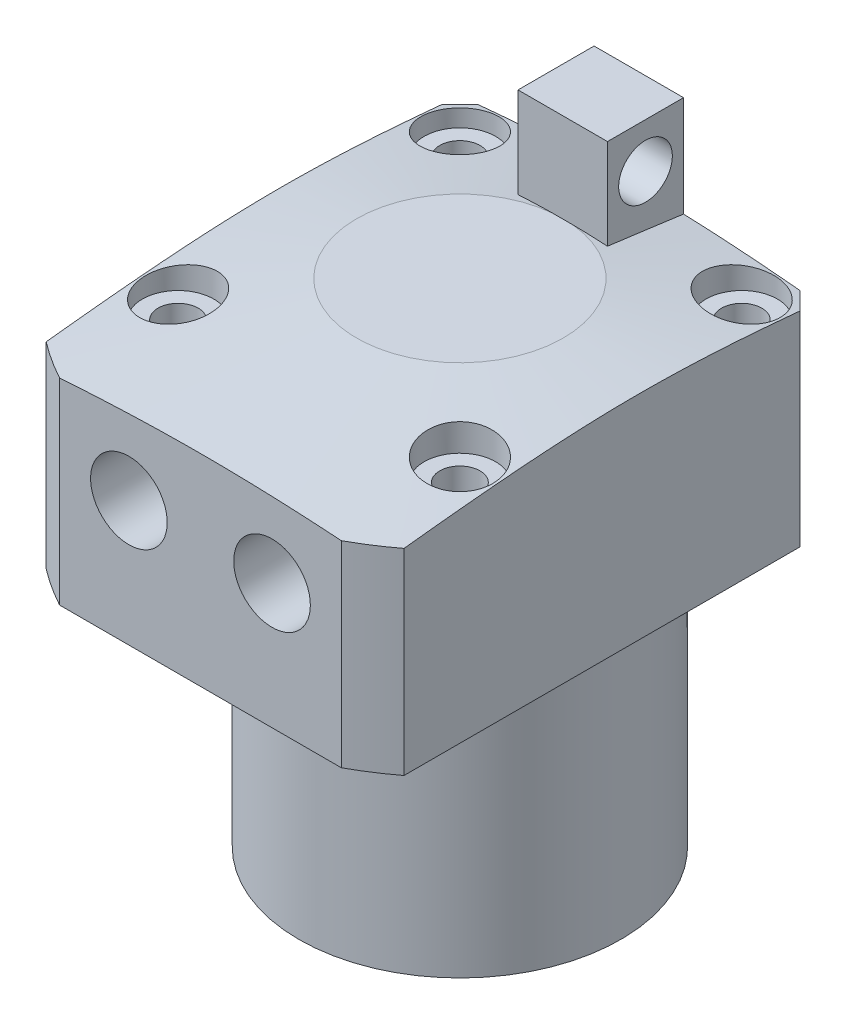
SolidWorks part; units mm, degrees
ref_plane "Front Plane" through (0, 0, 0) normal (0, 0, 1) x (1, 0, 0)
ref_plane "Top Plane" through (0, 0, 0) normal (0, 1, 0) x (1, 0, 0)
ref_plane "Right Plane" through (0, 0, 0) normal (1, 0, 0) x (0, 0, -1)
sketch "Sketch1" plane through (0, 0, 0) normal (0, 0, 1) x (1, 0, 0)
  line L0 (0, 87.0508) -> (0, 0) construction
  line L1 (0, 0) -> (-18, 0)
  line L2 (-18, 0) -> (-18, 30)
  line L3 (-18, 30) -> (-33, 30)
  line L4 (-33, 30) -> (-33, 51.9861)
  line L6 (-11.5549, 55) -> (0, 55)
  line L7 (0, 0) -> (0, 55)
  line L8 (-11.5549, 55) -> (-33, 51.9861)
  point P8 (-33, 55)
  dimension "D1" = 18
  dimension "D2" = 30
  dimension "D3" = 33
  dimension "D4" = 8
  dimension "D5" = 25
revolve "Revolve1" add sketch "Sketch1" angle 360 about L0
sketch "Sketch2" plane through (0, 55, 0) normal (0, 1, 0) x (1, 0, 0)
  line L0 (0, 0) -> (0, 20) construction
  line L1 (-20, 20) -> (20, 20)
  line L2 (-20, 20) -> (-20, -29)
  line L3 (-20, -29) -> (20, -29)
  line L4 (20, 20) -> (20, -29)
  dimension "D1" = 49
  dimension "D2" = 40
  dimension "D3" = 20
extrude "Cut-Extrude2" cut sketch "Sketch2" against normal through all flip side to cut
chamfer "Chamfer1" distance 2 angle 45 2 edges at (20, 41.3244, -20) (-20, 41.3244, -20)
hole_wizard "G1/8 Tapped Hole1" positions "Sketch6" profile "Sketch5" tap size "G1/8" standard "ISO"
sketch "Sketch6" plane through (0, 0, 29) normal (0, 0, 1) x (1, 0, 0)
  line L0 (-8, 44) -> (8, 44) construction
  line L4 (0, 44) -> (0, 55) construction
  line L5 (-15.748, 55) -> (15.748, 55) construction
  point P0 (-8, 44)
  point P1 (8, 44)
  dimension "D1" = 11
  dimension "D2" = 16
sketch "Sketch5" plane through (-8, 44, 29) normal (1, 0, 0) x (0, -1, 0)
  line L0 (0, 0) -> (0, 22.18)
  line L1 (0, 22.18) -> (4.283, 22.18)
  line L2 (4.283, 22.18) -> (4.283, 0)
  line L5 (4.283, 0) -> (0, 0)
  line L10 (0, 22.18) -> (-4.283, 22.18) construction
  line L11 (0, -6.35) -> (0, 107.95) construction
  dimension "Tap Drill Dia." = 8.566
  dimension "Tap Drill Depth" = 22.18
  dimension "Drill Angle" = 180
hole_wizard "CBORE for M4 Hex Socket Head Cap Screw2" positions "Sketch10" profile "Sketch9" counterbore size "M4" standard "ISO"
sketch "Sketch10" plane through (0, 55, 0) normal (0, 1, 0) x (-1, 0, 0)
  point P3 (-15.75, 15.75)
  point P6 (15.75, 15.75)
  point P9 (15.75, -15.75)
  point P12 (-15.75, -15.75)
sketch "Sketch9" plane through (15.75, 55, 15.75) normal (1, 0, 0) x (0, 0, 1)
  line L0 (0, 0) -> (0, 25)
  line L1 (2.25, 24.975) -> (2.275, 25)
  line L2 (2.25, 24.975) -> (2.25, 4)
  line L3 (2.25, 4) -> (4, 4)
  line L4 (4, 4) -> (4, 0)
  line L5 (4, 0) -> (0, 0)
  line L11 (0, -6.35) -> (0, 107.95) construction
  line L12 (2.275, 25) -> (0, 25)
  line L13 (-2.25, 24.975) -> (-2.275, 25) construction
  dimension "Thru Hole Dia." = 4.5
  dimension "Thru Hole Depth" = 25
  dimension "C'Bore Dia." = 8
  dimension "C'Bore Depth" = 4
  dimension "Far C'Sink Dia." = 4.55
  dimension "Far C'Sink Angle" = 90
hole_wizard "Ø8.0 (8) Diameter Hole2" positions "Sketch13" profile "Sketch12" hole size "Ø8.0" standard "ISO"
sketch "Sketch13" plane through (0, 30, 0) normal (0, -1, 0) x (1, 0, 0)
  point P0 (-8, 23.5)
  point P1 (8, 23.5)
sketch "Sketch12" plane through (-8, 30, 23.5) normal (1, 0, 0) x (0, 0, -1)
  line L0 (0, 0) -> (0, 1.5)
  line L1 (0, 1.5) -> (4, 1.5)
  line L2 (4, 1.5) -> (4, 0)
  line L5 (4, 0) -> (0, 0)
  line L10 (0, 1.5) -> (-4, 1.5) construction
  line L11 (0, -6.35) -> (0, 107.95) construction
  dimension "Hole Dia." = 8
  dimension "Hole Depth" = 1.5
  dimension "Drill Angle" = 180
sketch "Sketch14" plane through (0, 55, 0) normal (0, 1, 0) x (-1, 0, 0)
  line L0 (-18, -20) -> (18, -20) construction
  line L1 (5, -11.5) -> (-5, -11.5)
  line L2 (5, -11.5) -> (5, -20)
  line L3 (5, -20) -> (-5, -20)
  line L4 (-5, -11.5) -> (-5, -20)
  line L5 (5, -11.5) -> (-5, -20) construction
  line L6 (5, -20) -> (-5, -11.5) construction
  point P0 (0, -15.75)
  dimension "D1" = 10
extrude "Boss-Extrude1" add sketch "Sketch14" along normal blind 10 and the other way up to surface
hole_wizard "Ø6.0 (6) Diameter Hole1" positions "Sketch16" profile "Sketch15" hole size "Ø6.0" standard "ISO"
sketch "Sketch16" plane through (5, 0, 0) normal (1, 0, 0) x (0, 0, -1)
  line L0 (15.75, 65) -> (15.75, 55.9693) construction
  line L1 (11.5, 65) -> (20, 65) construction
  point P0 (15.75, 60)
  dimension "D1" = 5
sketch "Sketch15" plane through (5, 60, -15.75) normal (0, 1, 0) x (0, 0, -1)
  line L0 (0, 0) -> (0, 10)
  line L1 (0, 10) -> (3, 10)
  line L2 (3, 10) -> (3, 0)
  line L5 (3, 0) -> (0, 0)
  line L10 (0, 10) -> (-3, 10) construction
  line L11 (0, -6.35) -> (0, 107.95) construction
  dimension "Hole Dia." = 6
  dimension "Hole Depth" = 10
  dimension "Drill Angle" = 180
